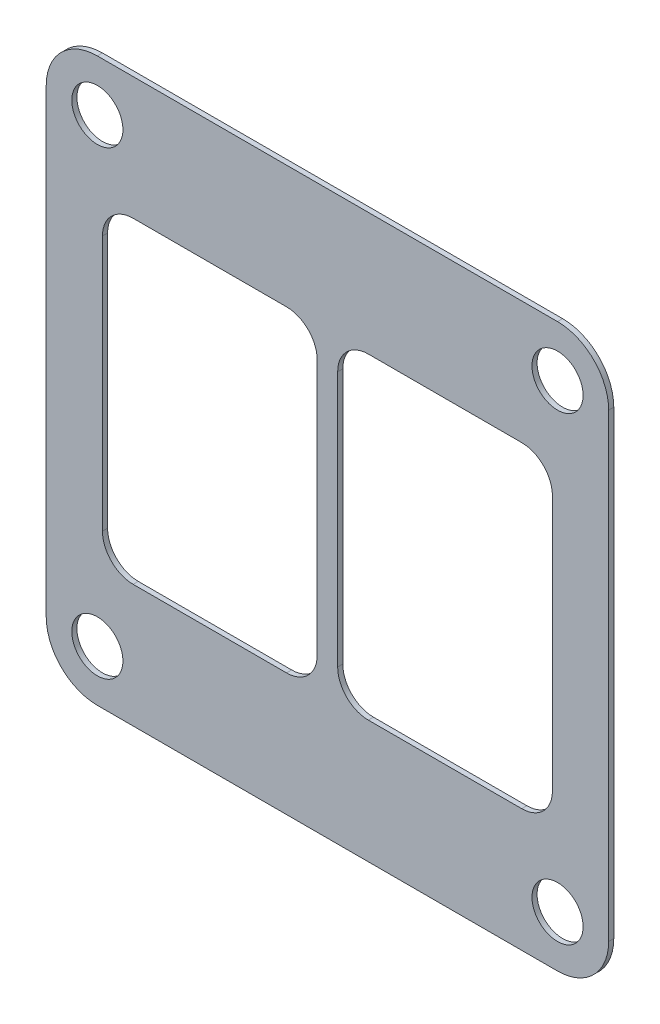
SolidWorks part; units mm, degrees
ref_plane "face" through (0, 0, 0) normal (0, 0, 1) x (1, 0, 0)
ref_plane "dessus" through (0, 0, 0) normal (0, 1, 0) x (1, 0, 0)
ref_plane "profil" through (0, 0, 0) normal (1, 0, 0) x (0, 0, -1)
sketch "Esquisse1" plane through (0, 0, 0) normal (0, 0, 1) x (1, 0, 0)
  line L1 (-27.5, 27.5) -> (27.5, 27.5)
  line L2 (-27.5, 27.5) -> (-27.5, -27.5)
  line L3 (-27.5, -27.5) -> (27.5, -27.5)
  line L4 (27.5, 27.5) -> (27.5, -27.5)
  dimension "D1" = 55
  dimension "D2" = 55
  dimension "D3" = 27.5
  dimension "D4" = 27.5
extrude "Base-Extrusion" add sketch "Esquisse1" along normal blind 0.5
fillet "Congé1" radius 5
sketch "Esquisse2" plane through (0, 0, 0.5) normal (0, 0, 1) x (1, 0, 0)
  line L0 (-33.3686, 0) -> (32.3016, 0) construction
  line L1 (0, 19.3034) -> (0, -30.3616) construction
  circle A0 centre (-22.5, 22.5) radius 2.5
  arc A1 (-22.5, 27.5) -> (-27.5, 22.5) centre (-22.5, 22.5) ccw construction
  circle A2 centre (22.5, 22.5) radius 2.5
  circle A3 centre (22.5, -22.5) radius 2.5
  circle A4 centre (-22.5, -22.5) radius 2.5
  dimension "D1" = 5
extrude "Enlèv. mat.-Extru.1" cut sketch "Esquisse2" against normal through all
sketch "Esquisse3" plane through (0, 0, 0.5) normal (0, 0, 1) x (1, 0, 0)
  line L1 (1, 15.5) -> (22, 15.5)
  line L2 (1, 15.5) -> (1, -15.5)
  line L3 (1, -15.5) -> (22, -15.5)
  line L4 (22, 15.5) -> (22, -15.5)
  dimension "D1" = 1
  dimension "D2" = 21
  dimension "D3" = 15.5
  dimension "D4" = 15.5
extrude "Enlèv. mat.-Extru.2" cut sketch "Esquisse3" against normal through all
fillet "Congé2" radius 3
mirror "Symétrie1" about plane through (0, 0, 0) normal (1, 0, 0)
